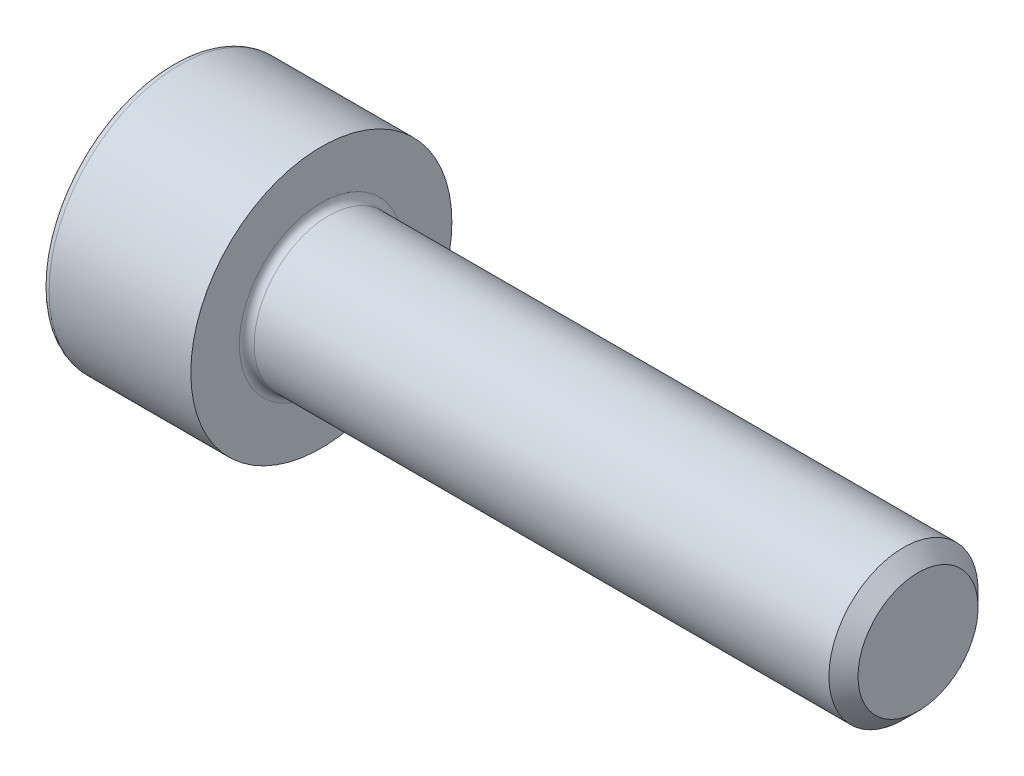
SolidWorks part; units mm, degrees
ref_plane "Plane1" through (0, 0, 0) normal (0, 0, 1) x (1, 0, 0)
ref_plane "Plane2" through (0, 0, 0) normal (0, 1, 0) x (1, 0, 0)
ref_plane "Plane3" through (0, 0, 0) normal (1, 0, 0) x (0, 0, -1)
sketch "BodySke" plane through (0, 0, 0) normal (0, 0, 1) x (1, 0, 0)
  line L0 (0, 0) -> (0, 3.5)
  line L1 (0, 3.5) -> (4, 3.5)
  line L2 (4, 3.5) -> (4, 2)
  line L3 (4, 2) -> (19.61, 2)
  line L4 (20, 1.61) -> (20, 0)
  line L5 (20, 0) -> (0, 0)
  line L6 (-31.75, 0) -> (127, 0) construction
  line L8 (20, 1.61) -> (19.61, 2)
  line L10 (20, -1.61) -> (19.61, -2) construction
  line L11 (4.7, 9.525) -> (4.7, 3.175) construction
  line L12 (4, 9.525) -> (4, 3.175) construction
  line L13 (-40, 9.525) -> (-40, 3.175) construction
  dimension "Diameter" = 4
  dimension "Head_ht" = 4
  dimension "Length" = 16
  dimension "Body_ch_ang" = 45
  dimension "Head_dia" = 7
  dimension "Minor_dia" = 3.22
  dimension "Advance" = 0.7
  dimension "Thread_nom" = 16
  dimension "Thread_length" = 60
revolve "Base-Revolve" add sketch "BodySke"
fillet "Fillet1" radius 0.2 1 edges at (4, 0, 2)
fillet "Fillet2" radius 0.2 1 edges at (0, 0, 3.5)
sketch "Sketch2" plane through (0, 0, 0) normal (0, 0, 1) x (1, 0, 0)
  line L0 (0, 1.5355) -> (2, 1.5355)
  line L1 (2, 1.5355) -> (2.8865, 0)
  line L2 (-31.75, 0) -> (127, 0) construction
  line L3 (2.8865, 0) -> (0, 0)
  line L4 (0, 0) -> (0, 1.5355)
  line L6 (0, 0) -> (47.625, 0) construction
  dimension "D1" = 1.5355
  dimension "D2" = 60
  dimension "Depth" = 2
revolve "Hex-PreBroach" cut sketch "Sketch2" angle 360 about L6
sketch "Sketch3" plane through (0, 0, 0) normal (-1, 0, 0) x (0, 0.5, 0.866)
  line L0 (0.8865, 1.5355) -> (-0.8865, 1.5355)
  line L1 (-0.8865, 1.5355) -> (-1.773, 0)
  line L2 (0.8865, 1.5355) -> (1.773, 0)
  line L3 (0.8865, -1.5355) -> (1.773, 0)
  line L4 (0.8865, -1.5355) -> (-0.8865, -1.5355)
  line L5 (-0.8865, -1.5355) -> (-1.773, 0)
  dimension "D1" = 1.5355
  dimension "D2" = 1.5355
  dimension "Hex_size" = 3.071
extrude "Hex" cut sketch "Sketch3" against normal blind 2
sketch "ThdSchSke" plane through (0, 0, 0) normal (0, 0, 1) x (1, 0, 0)
  line L0 (6.1, -1.61) -> (5.8269, -2)
  line L1 (6.1, -1.61) -> (6.3731, -2)
  line L2 (6.3731, -2) -> (6.3731, -2.5)
  line L3 (-3.175, 0) -> (5.1513, 0) construction
  line L4 (0, 3.3) -> (0, -3.3) construction
  line L5 (6.3731, -2.5) -> (5.8269, -2.5)
  line L6 (5.8269, -2.5) -> (5.8269, -2)
  dimension "Thread_minor" = 3.22
  dimension "Diameter" = 4
  dimension "Start" = 6.1
  dimension "SideAngle" = 55
  dimension "VeeAngle" = 70
  dimension "Overcut" = 5
revolve "ThreadSchematic" [suppressed] cut sketch "ThdSchSke" angle 360 about L3
pattern_linear "ThdSchPat" [suppressed]
equation "\"D2@Sketch3\" = \"Hex_size@Sketch3\" / 2"
equation "\"D1@Sketch3\" = \"Hex_size@Sketch3\" / 2"
equation "\"D1@Sketch2\" = \"Hex_size@Sketch3\" / 2"
equation "\"Thread_minor@ThreadCosmetic\"  =  \"Minor_dia@BodySke\""
equation "\"Depth@Sketch2\" =  \"Key_eng@Hex\""
equation "\"Thread_length@ThreadCosmetic\" = ((sgn( (\"Length@BodySke\" - \"Advance@BodySke\" * 3.0) - \"Thread_nom@BodySke\" )-1)*( (\"Length@BodySke\" - \"Advance@BodySke\" * 3.0) - \"Thread_nom@BodySke\" ))/-2+ \"Thread_no"
equation "\"Thread_minor@ThdSchSke\" = \"Minor_dia@BodySke\""
equation "\"Diameter@ThdSchSke\" = \"Diameter@BodySke\""
equation "\"Overcut@ThdSchSke\" = \"Diameter@BodySke\" * 1.25"
equation "\"Start@ThdSchSke\" = \"Head_ht@BodySke\" + \"Length@BodySke\" - \"Thread_length@ThreadCosmetic\"  '---Non-countersunk---"
equation "\"Num_threads@ThdSchPat\" = int( \"Thread_length@ThreadCosmetic\" / \"Advance@BodySke\" + 0.999 )  + 1"
equation "\"Advance@ThdSchPat\" = \"Thread_length@ThreadCosmetic\" /  (\"Num_threads@ThdSchPat\" - 1) 'relax it"
equation "\"Num_threads@ThdSchPat\" = \"Num_threads@ThdSchPat\" - sgn( \"Num_threads@ThdSchPat\" - 1) '---chamfered tips only---"
